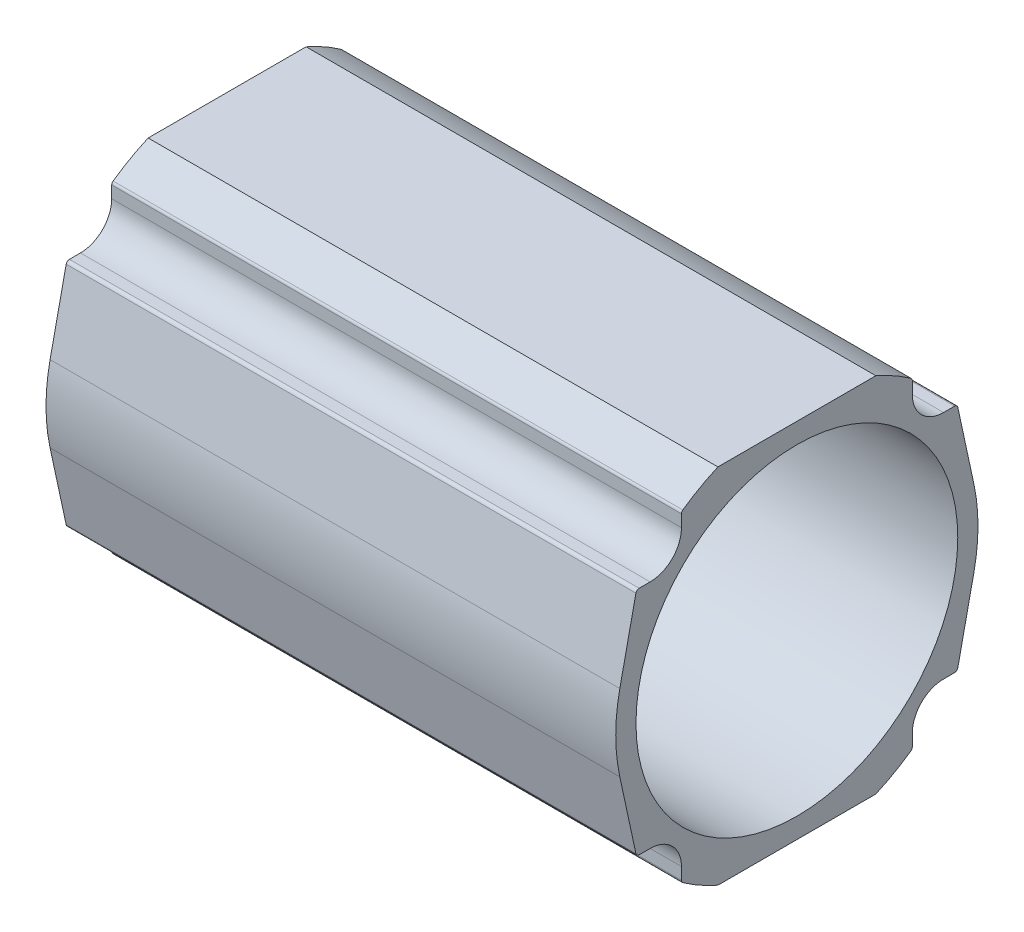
SolidWorks part; units mm, degrees
ref_plane "Plan de face" through (0, 0, 0) normal (0, 0, 1) x (1, 0, 0)
ref_plane "Plan de dessus" through (0, 0, 0) normal (0, 1, 0) x (1, 0, 0)
ref_plane "Plan de droite" through (0, 0, 0) normal (1, 0, 0) x (0, 0, -1)
ref_plane "Plan4" through (0, 0, 0) normal (1, 0, 0) x (0, 0, -1)
sketch "Esquisse1" plane through (0, 0, 0) normal (1, 0, 0) x (0, 0, -1)
  line L0 (-26.8805, -5.8044) -> (-24.435, -17.1294)
  line L1 (-23.9463, -17.5239) -> (-22.2739, -17.5239)
  line L2 (-17.5239, -22.2739) -> (-17.5239, -24.0923)
  line L3 (-11.9896, -27.5) -> (11.9896, -27.5)
  line L4 (17.5239, -24.0923) -> (17.5239, -22.2739)
  line L5 (22.2739, -17.5239) -> (23.9463, -17.5239)
  line L6 (24.435, -17.1294) -> (26.8805, -5.8044)
  line L7 (26.8805, 5.8044) -> (24.435, 17.1294)
  line L8 (23.9463, 17.5239) -> (22.2739, 17.5239)
  line L9 (17.5239, 22.2739) -> (17.5239, 24.0923)
  line L10 (11.9896, 27.5) -> (-11.9896, 27.5)
  line L11 (-17.5239, 24.0923) -> (-17.5239, 22.2739)
  line L12 (-22.2739, 17.5239) -> (-23.9463, 17.5239)
  line L13 (-24.435, 17.1294) -> (-26.8805, 5.8044)
  arc A0 (-26.8805, 5.8044) -> (-26.8805, -5.8044) centre (0, 0) ccw
  arc A1 (-24.435, -17.1294) -> (-23.9463, -17.5239) centre (-23.9463, -17.0239) ccw
  arc A2 (-22.2739, -17.5239) -> (-17.5239, -22.2739) centre (-22.2739, -22.2739) cw
  arc A3 (-17.5239, -24.0923) -> (-17.3124, -24.5006) centre (-17.0239, -24.0923) ccw
  arc A4 (-17.3124, -24.5006) -> (-11.9896, -27.5) centre (0, 0) ccw
  arc A5 (11.9896, -27.5) -> (17.3124, -24.5006) centre (0, 0) ccw
  arc A6 (17.3124, -24.5006) -> (17.5239, -24.0923) centre (17.0239, -24.0923) ccw
  arc A7 (17.5239, -22.2739) -> (22.2739, -17.5239) centre (22.2739, -22.2739) cw
  arc A8 (23.9463, -17.5239) -> (24.435, -17.1294) centre (23.9463, -17.0239) ccw
  arc A9 (26.8805, -5.8044) -> (26.8805, 5.8044) centre (0, 0) ccw
  arc A10 (24.435, 17.1294) -> (23.9463, 17.5239) centre (23.9463, 17.0239) ccw
  arc A11 (22.2739, 17.5239) -> (17.5239, 22.2739) centre (22.2739, 22.2739) cw
  arc A12 (17.5239, 24.0923) -> (17.3124, 24.5006) centre (17.0239, 24.0923) ccw
  arc A13 (17.3124, 24.5006) -> (11.9896, 27.5) centre (0, 0) ccw
  arc A14 (-11.9896, 27.5) -> (-17.3124, 24.5006) centre (0, 0) ccw
  arc A15 (-17.3124, 24.5006) -> (-17.5239, 24.0923) centre (-17.0239, 24.0923) ccw
  arc A16 (-17.5239, 22.2739) -> (-22.2739, 17.5239) centre (-22.2739, 22.2739) cw
  arc A17 (-23.9463, 17.5239) -> (-24.435, 17.1294) centre (-23.9463, 17.0239) ccw
extrude "Extrusion1" add sketch "Esquisse1" along normal blind 86.5
sketch "Esquisse2" plane through (86.5, 0, 0) normal (1, 0, 0) x (0, 0, -1)
  circle A0 centre (0, 0) radius 24.4284
extrude "Enlèv. mat.-Extru.1" cut sketch "Esquisse2" against normal through all
